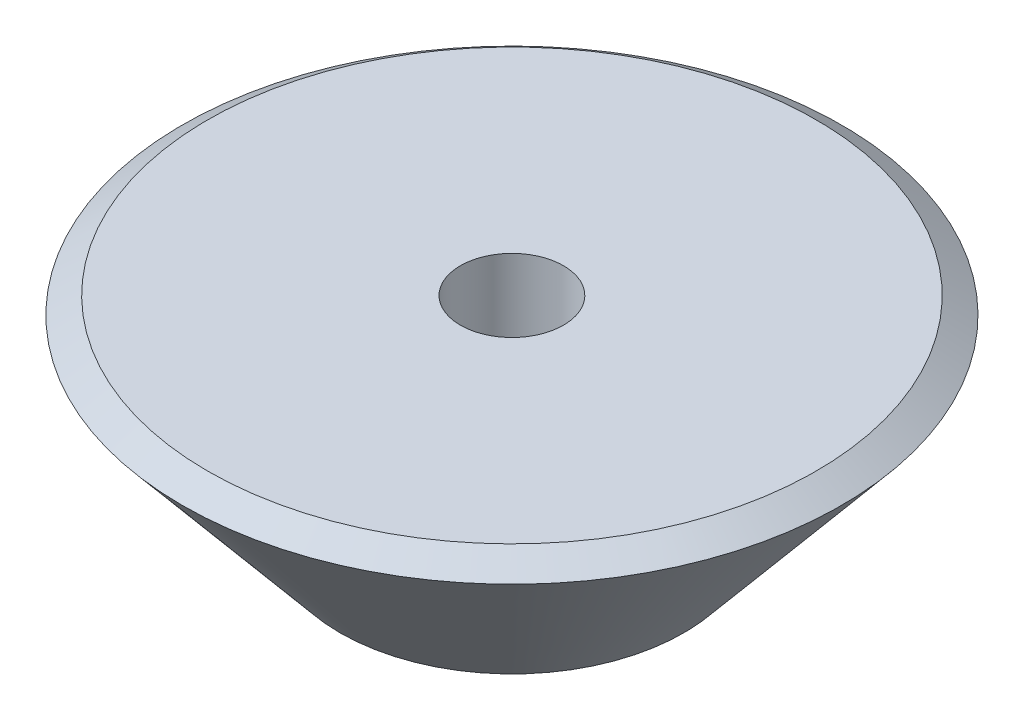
SolidWorks part; units mm, degrees
ref_plane "Face" through (0, 0, 0) normal (0, 0, 1) x (1, 0, 0)
ref_plane "Dessus" through (0, 0, 0) normal (0, 1, 0) x (1, 0, 0)
ref_plane "Droite" through (0, 0, 0) normal (1, 0, 0) x (0, 0, -1)
sketch "Esquisse1" plane through (0, 0, 0) normal (0, 0, 1) x (1, 0, 0)
  line L0 (0, -52.5) -> (0, 52.5) construction
  line L1 (-5, 6) -> (5, 6)
  line L2 (-5, 6) -> (-5, -6)
  line L3 (-5, -6) -> (5, -6)
  line L4 (5, 6) -> (5, -6)
  line L5 (52.5, 0) -> (-52.5, 0) construction
  line L6 (-11.7982, 14.1578) -> (12.0318, -14.4381) construction
  line L7 (9.0719, 10.8863) -> (-13.5972, -16.3167) construction
  line L8 (0, 10.8863) -> (0, -9.4324) construction
  line L9 (-10.4219, 0) -> (9.0719, 0) construction
  line L10 (-3, 4) -> (3, 4)
  line L11 (3, 4) -> (3, -4)
  line L12 (-3, -4) -> (3, -4)
  line L13 (-3, 4) -> (-3, -4)
  line L14 (-7, 8) -> (7, 8)
  line L15 (7, 8) -> (7, -8)
  line L16 (-7, -8) -> (7, -8)
  line L17 (-7, 8) -> (-7, -8)
  point P4 (0, -6)
  point P7 (5, 0)
  dimension "D1" = 10
  dimension "D2" = 12
  dimension "D3" = 2
  dimension "D4" = 2
sketch "Esquisse2" plane through (0, 0, 0) normal (0, 0, 1) x (1, 0, 0)
  line L0 (0, 8) -> (0, 4)
  line L1 (-7, 8) -> (7, 8) construction
  line L2 (-3, 4) -> (3, 4) construction
  line L3 (0, 4) -> (-3.3333, 4)
  line L4 (0, 8) -> (-5.8999, 8)
  line L5 (-6.3906, 7.6688) -> (-3.3333, 4)
  line L6 (-6.3906, 7.6688) -> (-5.8999, 8)
  line L7 (-11.7982, 14.1578) -> (12.0318, -14.4381) construction
  line L8 (0, 9.4375) -> (0, 3.2955) construction
  line L9 (0, 10.8863) -> (0, -9.4324) construction
revolve "Base-Révolution" add sketch "Esquisse2" angle 360 about L8
sketch "Esquisse3" plane through (0, 8, 0) normal (0, 1, 0) x (-1, 0, 0)
  circle A0 centre (0, 0) radius 1
  dimension "D1" = 2
extrude "Enlèv. mat.-Extru.1" cut sketch "Esquisse3" against normal blind 10
